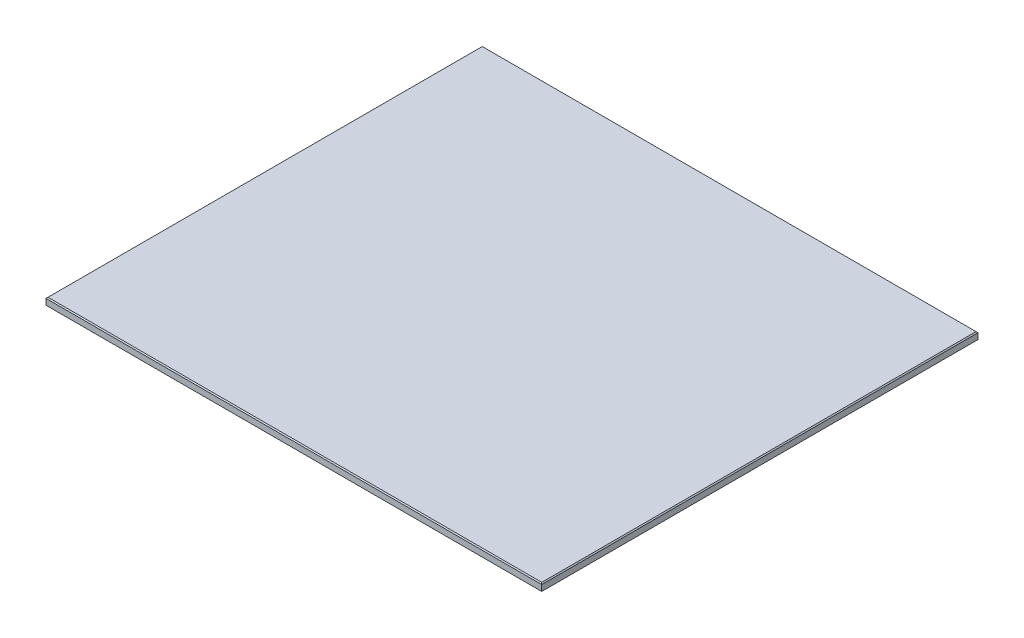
SolidWorks part; units mm, degrees
ref_plane "Спереди" through (0, 0, 0) normal (0, 0, 1) x (1, 0, 0)
ref_plane "Сверху" through (0, 0, 0) normal (0, 1, 0) x (1, 0, 0)
ref_plane "Справа" through (0, 0, 0) normal (1, 0, 0) x (0, 0, -1)
sketch "Эскиз1" plane through (0, 0, 0) normal (0, 1, 0) x (1, 0, 0)
  line L1 (-125, -110) -> (125, -110)
  line L2 (-125, -110) -> (-125, 110)
  line L3 (-125, 110) -> (125, 110)
  line L4 (125, -110) -> (125, 110)
  line L5 (-125, -110) -> (125, 110) construction
  line L6 (-125, 110) -> (125, -110) construction
  point P0 (0, 0)
  dimension "D1" = 250
  dimension "D2" = 220
extrude "Бобышка-Вытянуть1" add sketch "Эскиз1" along normal blind 4
chamfer "Фаска1" distance 0.5 angle 45 8 edges at (0, 0, -110) (-125, 0, 0) (0, 0, 110) (125, 0, 0) (0, 4, 110) (-125, 4, 0) (0, 4, -110) (125, 4, 0)
